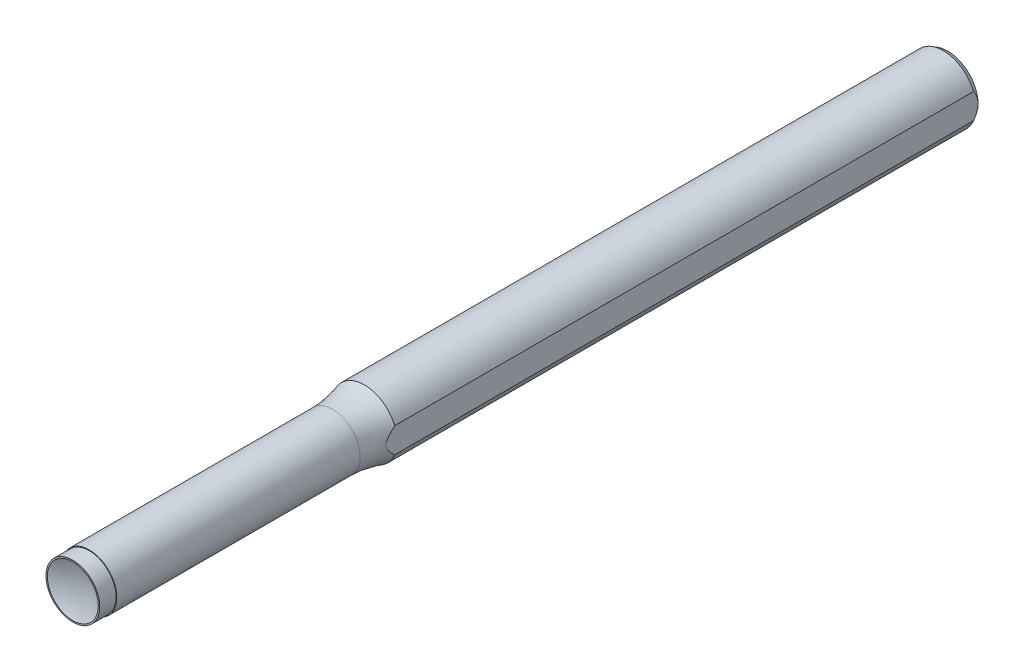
SolidWorks part; units mm, degrees
ref_plane "Front Plane" through (0, 0, 0) normal (0, 0, 1) x (1, 0, 0)
ref_plane "Top Plane" through (0, 0, 0) normal (0, 1, 0) x (1, 0, 0)
ref_plane "Right Plane" through (0, 0, 0) normal (1, 0, 0) x (0, 0, -1)
sketch "Sketch1" plane through (0, 0, 0) normal (0, 0, 1) x (1, 0, 0)
  circle A0 centre (0, 0) radius 4.765
  dimension "D1" = 9.53
extrude "Boss-Extrude1" add sketch "Sketch1" against normal blind 127
sketch "Sketch2" plane through (0, 0, 0) normal (0, 0, 1) x (1, 0, 0)
  circle A0 centre (0, 0) radius 4
  dimension "D1" = 8
extrude "Cut-Extrude1" cut sketch "Sketch2" against normal blind 42.3333 flip side to cut
sketch "Sketch3" plane through (0, 0, 0) normal (0, 0, 1) x (1, 0, 0)
  circle A0 centre (0, 0) radius 3.9
  dimension "D1" = 7.8
extrude "Cut-Extrude2" cut sketch "Sketch3" against normal blind 2.3825 flip side to cut
sketch "Sketch4" plane through (0, 0, 0) normal (1, 0, 0) x (0, 0, -1)
  line L0 (0, 0) -> (0, 3.7)
  line L1 (0, 3.9) -> (0, -3.9) construction
  line L2 (0.7476, 0) -> (0.7476, 3.7) construction
  line L3 (0, 0) -> (0.7476, 0)
  line L4 (0, 0) -> (0, -3.7) construction
  arc A0 (0.7476, 0) -> (0, 3.7) centre (-8.7824, 0) ccw
  dimension "D2" = 9.53
  dimension "D1" = 7.4
revolve "Cut-Revolve1" cut sketch "Sketch4" angle 360 about L3
chamfer "Chamfer1" distance 0.6353 angle 30 1 edges at (4.765, 0, -127)
sketch "Sketch5" plane through (0, 0, 0) normal (1, 0, 0) x (0, 0, -1)
  line L0 (42.3333, 0) -> (37.7196, 0)
  line L1 (42.3333, 4.765) -> (42.3333, -4.765) construction
  line L2 (37.7196, 0) -> (37.7196, 4)
  line L3 (42.3333, 4) -> (2.3825, 4) construction
  line L4 (42.3333, 4.765) -> (42.3333, 0)
  line L5 (37.7196, 4) -> (42.3333, 4) construction
  arc A0 (37.7196, 4) -> (42.3333, 4.765) centre (37.7196, 18.295) ccw
  dimension "D1" = 14.295
revolve "Revolve1" add sketch "Sketch5" angle 360 about L0
sketch "Sketch6" plane through (0, 0, 0) normal (1, 0, 0) x (0, 0, -1)
  line L0 (84.6667, 0) -> (98.9617, 0)
  line L1 (84.6667, 0) -> (84.6667, 9.53)
  line L2 (84.6667, 9.53) -> (90.7084, 9.53)
  line L3 (98.9617, 0) -> (98.9617, 4.765)
  line L4 (126.3647, 4.765) -> (42.3333, 4.765) construction
  line L5 (98.9617, 4.765) -> (84.6667, 4.765) construction
  line L6 (127, -4.765) -> (127, 4.765) construction
  arc A0 (98.9617, 4.765) -> (90.7084, 9.53) centre (98.9617, 14.295) cw
  dimension "D2" = 9.53
  dimension "D1" = 42.3333
  dimension "D3" = 14.295
revolve "Revolve2" [suppressed] add sketch "Sketch6" angle 360 about L0
sketch "Sketch7" plane through (0, 0, -127) normal (0, 0, -1) x (-1, 0, 0)
  line L9 (-8.0649, 1.8333) -> (-4.3982, 1.8333)
  line L10 (-8.0649, 1.8333) -> (-8.0649, -1.8333)
  line L11 (-8.0649, -1.8333) -> (-4.3982, -1.8333)
  line L12 (-4.3982, 1.8333) -> (-4.3982, -1.8333)
  circle A5 centre (0, 0) radius 4.765 construction
  circle A6 centre (0, 0) radius 4.3982 construction
  point P8 (-4.3982, 0)
extrude "Cut-Extrude3" cut sketch "Sketch7" against normal through all
